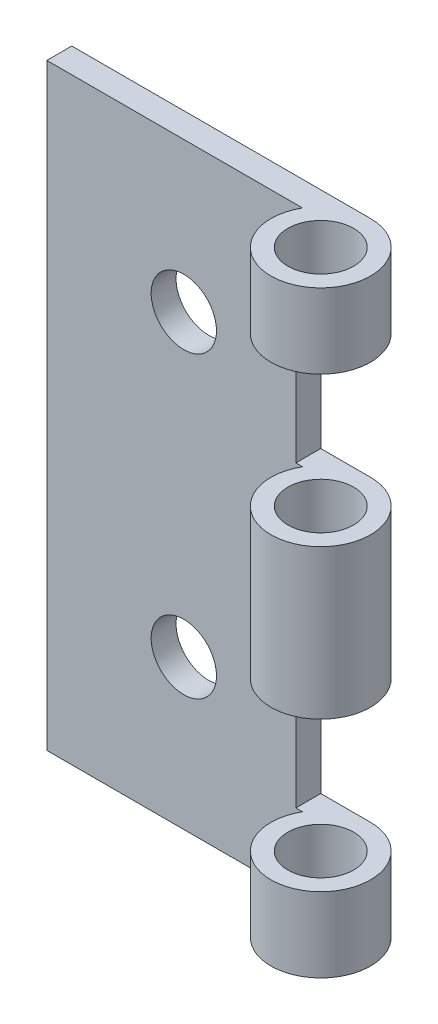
SolidWorks part; units mm, degrees
ref_plane "Front"
ref_plane "Top" through (0, 0, 0) normal (0, 1, 0) x (1, 0, 0)
ref_plane "Right" through (0, 0, 0) normal (1, 0, 0) x (0, 0, -1)
sketch "Sketch1" plane through (0, 0, 0) normal (0, 0, 1) x (1, 0, 0)
  line L1 (0, 0) -> (-38.1, 0)
  line L2 (0, 0) -> (0, 76.2)
  line L3 (0, 76.2) -> (-38.1, 76.2)
  line L4 (-38.1, 0) -> (-38.1, 76.2)
  dimension "D1" = 76.2
  dimension "D2" = 38.1
extrude "Base-Extrude" add sketch "Sketch1" against normal blind 3.175
sketch "Sketch2" plane through (0, 0, 0) normal (0, 0, 1) x (1, 0, 0)
  line L0 (-38.1, 76.2) -> (-38.1, 0) construction
  line L1 (0, 76.2) -> (-38.1, 76.2) construction
  circle A0 centre (-20.6375, 57.15) radius 4.1656
  dimension "D1" = 8.3312
  dimension "D2" = 17.4625
  dimension "D3" = 19.05
extrude "Cut-Extrude1" cut sketch "Sketch2" against normal through all
sketch "Sketch3" plane through (0, 0, 0) normal (0, 0, 1) x (1, 0, 0)
  line L0 (-38.1, 0) -> (0, 0) construction
  line L1 (-38.1, 76.2) -> (-38.1, 0) construction
  circle A0 centre (-20.6375, 19.05) radius 4.1656
  dimension "D1" = 8.3312
  dimension "D2" = 19.05
  dimension "D3" = 17.4625
extrude "Cut-Extrude2" cut sketch "Sketch3" against normal through all
sketch "Sketch4" plane through (0, 0, 0) normal (0, -1, 0) x (1, 0, 0)
  line L0 (-38.1, -3.175) -> (0, -3.175) construction
  circle A0 centre (0, 3.175) radius 6.35
  dimension "D1" = 12.7
extrude "Boss-Extrude1" add sketch "Sketch4" against normal up to vertex
sketch "Sketch5" plane through (0, 0, 0) normal (0, -1, 0) x (1, 0, 0)
  circle A0 centre (0, 3.175) radius 4.191
  dimension "D1" = 8.382
extrude "Cut-Extrude3" cut sketch "Sketch5" against normal up to vertex
sketch "Sketch6" plane through (0, 0, 0) normal (0, 0, 1) x (1, 0, 0)
  line L0 (8.072, 66.675) -> (-6.35, 66.675)
  line L1 (-6.35, 76.2) -> (-6.35, 0) construction
  line L2 (-6.35, 66.675) -> (-6.35, 47.625)
  line L3 (-6.35, 47.625) -> (8.072, 47.625)
  line L4 (6.35, 76.2) -> (-6.35, 76.2) construction
  dimension "D1" = 9.525
  dimension "D2" = 19.05
extrude "Cut-Extrude4" cut sketch "Sketch6" against normal through all and the other way through all
sketch "Sketch7" plane through (0, 0, 0) normal (0, 0, 1) x (1, 0, 0)
  line L0 (10.9522, 28.575) -> (-6.35, 28.575)
  line L1 (-6.35, 47.625) -> (-6.35, 0) construction
  line L2 (-6.35, 28.575) -> (-6.35, 9.525)
  line L3 (-6.35, 9.525) -> (10.9522, 9.525)
  line L4 (-6.35, 0) -> (6.35, 0) construction
  dimension "D1" = 9.525
  dimension "D2" = 19.05
extrude "Cut-Extrude5" cut sketch "Sketch7" against normal through all and the other way through all
